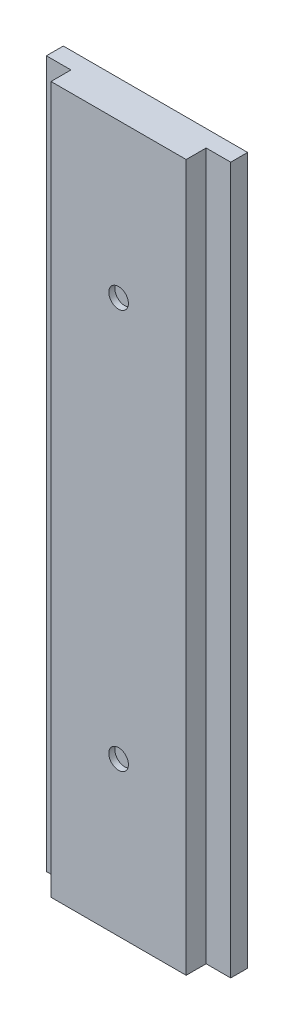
SolidWorks part; units mm, degrees
ref_plane "Plan de face" through (0, 0, 0) normal (0, 0, 1) x (1, 0, 0)
ref_plane "Plan de dessus" through (0, 0, 0) normal (0, 1, 0) x (1, 0, 0)
ref_plane "Plan de droite" through (0, 0, 0) normal (1, 0, 0) x (0, 0, -1)
sketch "Esquisse1" plane through (0, 0, 0) normal (0, 0, 1) x (1, 0, 0)
  line L1 (20, 40) -> (50, 40)
  line L2 (20, 40) -> (20, -75)
  line L3 (20, -75) -> (50, -75)
  line L4 (50, 40) -> (50, -75)
  dimension "D1" = 30
  dimension "D2" = 115
extrude "Extrusion1" add sketch "Esquisse1" along normal blind 6
sketch "Esquisse2" plane through (0, 0, 6) normal (0, 0, 1) x (1, 0, 0)
  line L0 (20, -75) -> (50, -75) construction
  line L1 (20, 40) -> (24, 40)
  line L2 (20, 40) -> (20, -75)
  line L3 (20, -75) -> (24, -75)
  line L4 (24, 40) -> (24, -75)
  line L5 (50, -75) -> (50, 40) construction
  line L6 (50, 40) -> (46, 40)
  line L7 (50, 40) -> (50, -75)
  line L8 (50, -75) -> (46, -75)
  line L9 (46, 40) -> (46, -75)
  line L10 (50, 40) -> (20, 40) construction
  dimension "D1" = 4
  dimension "D2" = 4
extrude "Enlèv. mat.-Extru.1" cut sketch "Esquisse2" against normal blind 3.25
sketch "Esquisse3" plane through (0, 0, 6) normal (0, 0, 1) x (1, 0, 0)
  line L0 (20, 40) -> (20, -75) construction
  line L1 (46, 40) -> (24, 40) construction
  line L2 (24, -75) -> (46, -75) construction
  circle A0 centre (35, 15) radius 1.6
  circle A1 centre (35, -50) radius 1.6
  dimension "D1" = 15
  dimension "D2" = 15
  dimension "D3" = 25
  dimension "D4" = 25
extrude "Enlèv. mat.-Extru.2" cut sketch "Esquisse3" against normal blind 1
